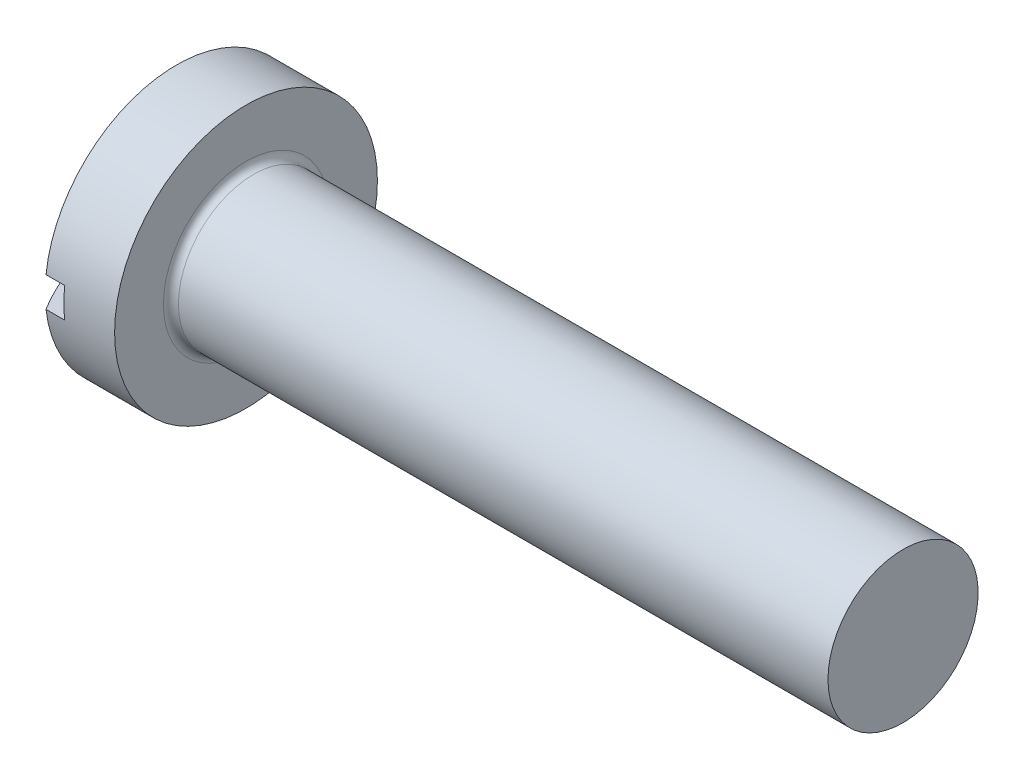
SolidWorks part; units mm, degrees
ref_plane "Plane1" through (0, 0, 0) normal (0, 0, 1) x (1, 0, 0)
ref_plane "Plane2" through (0, 0, 0) normal (0, 1, 0) x (1, 0, 0)
ref_plane "Plane3" through (0, 0, 0) normal (1, 0, 0) x (0, 0, -1)
sketch "BodySke" plane through (0, 0, 0) normal (0, 0, 1) x (1, 0, 0)
  line L0 (5.7, 4) -> (5.7, 7)
  line L1 (5.7, 7) -> (2, 7)
  line L2 (-25.4, 0) -> (127, 0) construction
  line L4 (5.7, 4) -> (40.7, 4)
  line L5 (40.7, 4) -> (40.7, 0)
  line L6 (40.7, 0) -> (0, 0)
  line L7 (5.7, -4) -> (40.7, -4) construction
  line L8 (6.95, 6.35) -> (6.95, -3.175) construction
  line L9 (10.7, 6.35) -> (10.7, -3.175) construction
  arc A0 (0, 0) -> (2, 7) centre (13.25, 0) cw
  dimension "Oval_ht" = 2
  dimension "Head_ht" = 5.7
  dimension "Diameter" = 8
  dimension "Length" = 35
  dimension "Head_dia" = 14
  dimension "Advance" = 1.25
  dimension "Thread_nom" = 30
revolve "Base-Revolve" add sketch "BodySke"
fillet "Fillet1" radius 0.4 1 edges at (5.7, 0, 4)
sketch "Sketch2" plane through (0, 0, 0) normal (1, 0, 0) x (0, 0, -1)
  line L0 (7, -0.8) -> (7, 0.8)
  line L1 (7, 0.8) -> (-7, 0.8)
  line L2 (-7, 0.8) -> (-7, -0.8)
  line L3 (-7, -0.8) -> (7, -0.8)
  dimension "D1" = 14
  dimension "D2" = 7
  dimension "D3" = 0.8
  dimension "Slot_width" = 1.6
extrude "Slot" cut sketch "Sketch2" along normal blind 3
sketch "ThdSchSke" plane through (0, 0, 0) normal (0, 0, 1) x (1, 0, 0)
  line L0 (10.7, -3.3095) -> (10.2165, -4)
  line L1 (10.7, -3.3095) -> (11.1835, -4)
  line L2 (11.1835, -4) -> (11.1835, -5)
  line L3 (-3.175, 0) -> (5.1513, 0) construction
  line L5 (11.1835, -5) -> (10.2165, -5)
  line L6 (10.2165, -5) -> (10.2165, -4)
  dimension "Thread_minor" = 6.619
  dimension "Diameter" = 8
  dimension "Start" = 10.7
  dimension "SideAngle" = 55
  dimension "VeeAngle" = 70
  dimension "Overcut" = 10
revolve "ThreadSchematic" [suppressed] cut sketch "ThdSchSke" angle 360 about L3
pattern_linear "ThdSchPat" [suppressed]
equation "' \"Diameter@BodySke\" = 8"
equation "' \"Length@BodySke\" = 35"
equation "' \"Head_dia@BodySke\" = 14"
equation "' \"Oval_ht@BodySke\" = 2"
equation "' \"Head_ht@BodySke\" = 5.7"
equation "' \"Thread_nom@BodySke\" =  30"
equation "' \"Slot_width@Sketch2\" = 1.6"
equation "' \"Slot_depth@Slot\" = 3"
equation "' \"Thread_minor@ThreadCosmetic\" = 6.619"
equation "' \"Advance@BodySke\" = 1.25"
equation "\"D1@Sketch2\" = \"Head_dia@BodySke\""
equation "\"D2@Sketch2\" = \"D1@Sketch2\" / 2"
equation "\"D3@Sketch2\" = \"Slot_width@Sketch2\" / 2"
equation "\"Thread_length@ThreadCosmetic\" = ((sgn( (\"Length@BodySke\" - \"Advance@BodySke\" * 2 ) - \"Thread_nom@BodySke\" )-1)*( (\"Length@BodySke\" - \"Advance@BodySke\" * 2 ) - \"Thread_nom@BodySke\" ))/-2+ \"Thread_nom@"
equation "\"Thread_minor@ThdSchSke\" = \"Thread_minor@ThreadCosmetic\""
equation "\"Diameter@ThdSchSke\" = \"Diameter@BodySke\""
equation "\"Overcut@ThdSchSke\" = \"Diameter@BodySke\" * 1.25"
equation "\"Start@ThdSchSke\" = \"Head_ht@BodySke\" + \"Length@BodySke\" - \"Thread_length@ThreadCosmetic\"  '---Non-countersunk---"
equation "\"Num_threads@ThdSchPat\" = int( \"Thread_length@ThreadCosmetic\" / \"Advance@BodySke\" + 0.999 )  + 1"
equation "\"Advance@ThdSchPat\" = \"Thread_length@ThreadCosmetic\" /  (\"Num_threads@ThdSchPat\" - 1) 'relax it"
